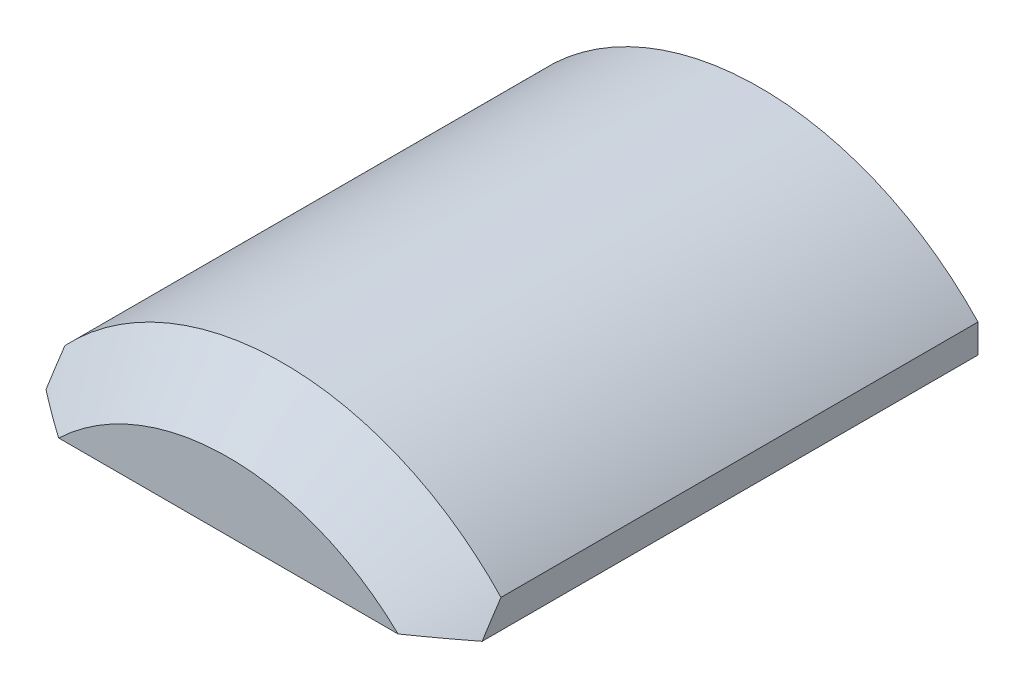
SolidWorks part; units mm, degrees
ref_plane "Front Plane" through (0, 0, 0) normal (0, 0, 1) x (1, 0, 0)
ref_plane "Top Plane" through (0, 0, 0) normal (0, 1, 0) x (1, 0, 0)
ref_plane "Right Plane" through (0, 0, 0) normal (1, 0, 0) x (0, 0, -1)
sketch "Sketch1" plane through (0, 0, 0) normal (0, 0, 1) x (1, 0, 0)
  line L0 (101.6, 95.8829) -> (101.6, 82.55)
  line L1 (-101.6, 95.8829) -> (-101.6, -95.8829) construction
  line L2 (-101.6, 0) -> (101.6, 0) construction
  line L3 (101.6, -95.8829) -> (101.6, 95.8829) construction
  line L4 (101.6, 82.55) -> (-101.6, 82.55)
  line L5 (-101.6, 82.55) -> (-101.6, 95.8829)
  arc A0 (101.6, 95.8829) -> (-101.6, 95.8829) centre (0, 0) ccw
  arc A1 (101.6, -95.8829) -> (-101.6, -95.8829) centre (0, 0) cw construction
  dimension "D1" = 139.7
  dimension "D2" = 101.6
  dimension "D3" = 101.6
  dimension "D4" = 82.55
extrude "Boss-Extrude1" add sketch "Sketch1" along normal blind 247.65
chamfer "Chamfer1" distance 25.4 angle 45 1 edges at (0, 139.7, 247.65)
